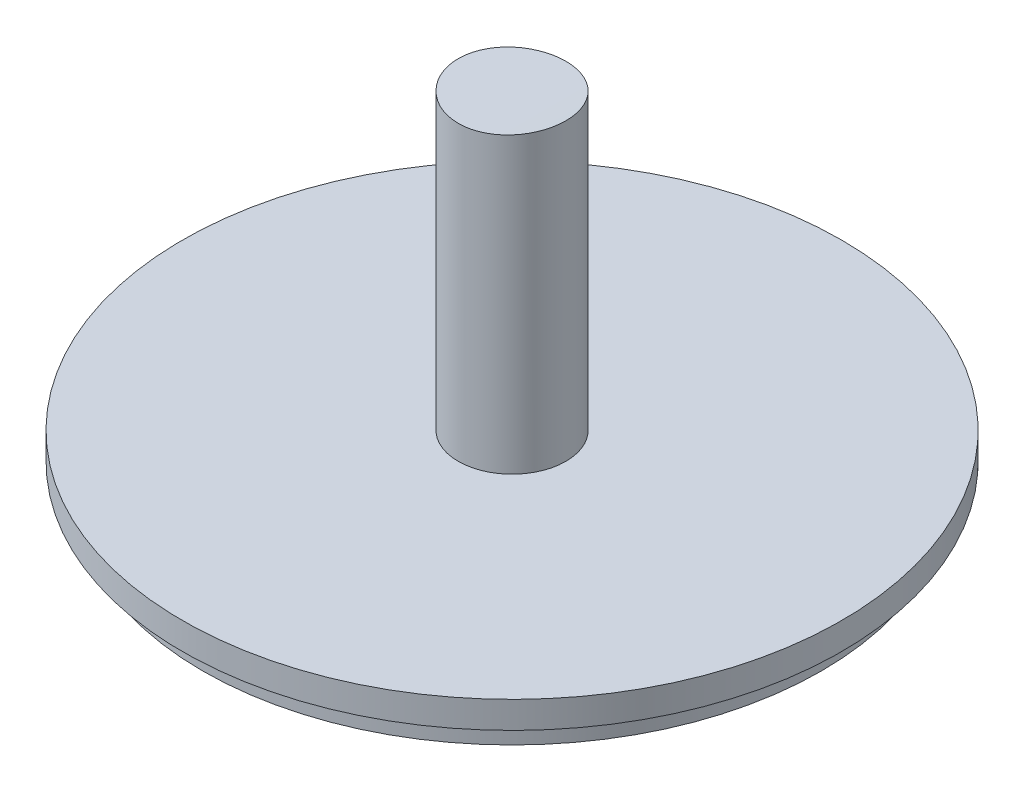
SolidWorks part; units mm, degrees
ref_plane "Front Plane" through (0, 0, 0) normal (0, 0, 1) x (1, 0, 0)
ref_plane "Top Plane" through (0, 0, 0) normal (0, 1, 0) x (1, 0, 0)
ref_plane "Right Plane" through (0, 0, 0) normal (1, 0, 0) x (0, 0, -1)
sketch "Sketch1" plane through (0, 0, 0) normal (0, 0, 1) x (1, 0, 0)
  line L0 (0, 0) -> (0, 12.7) construction
  line L1 (0, 0) -> (72.9996, 0)
  line L2 (0, 0) -> (0, 12.7)
  line L3 (72.9996, 0) -> (72.9996, 6.35)
  line L4 (72.9996, 6.35) -> (77.7748, 6.35)
  line L5 (77.7748, 6.35) -> (77.7748, 12.7)
  line L6 (77.7748, 12.7) -> (0, 12.7)
  point P3 (0, 0)
  point P5 (77.7748, 9.525)
  point P9 (72.9996, -0.0109)
  dimension "D1" = 12.7
  dimension "D2" = 72.9996
  dimension "D3" = 6.35
  dimension "D4" = 77.7748
revolve "Revolve1" add sketch "Sketch1" angle 360 about L0
sketch "Sketch2" plane through (0, 12.7, 0) normal (0, 1, 0) x (1, 0, 0)
  circle A0 centre (0, 0) radius 12.7
  dimension "D1" = 25.4
extrude "Boss-Extrude1" add sketch "Sketch2" along normal blind 76.2
sketch "Sketch4" plane through (0, 0, 0) normal (0, 0, 1) x (1, 0, 0)
  circle A0 centre (0, 231.775) radius 149.9997
  point P2 (0, 232.0228)
  dimension "D1" = 299.9994
  dimension "D2" = 231.775
extrude "Cut-Extrude1" cut sketch "Sketch4" against normal mid plane 76.2
